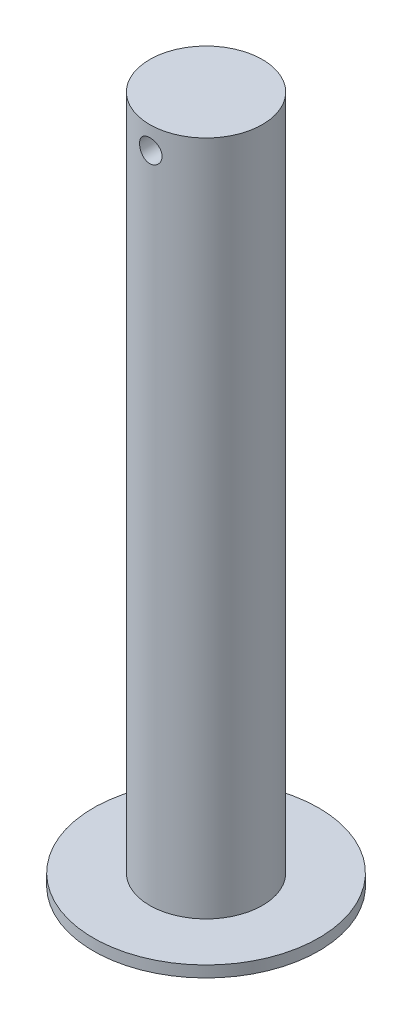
SolidWorks part; units mm, degrees
other "DetailItem2"
ref_plane "Front Plane" through (0, 0, 0) normal (0, 0, 1) x (1, 0, 0)
ref_plane "Top Plane" through (0, 0, 0) normal (0, 1, 0) x (1, 0, 0)
ref_plane "Right Plane" through (0, 0, 0) normal (1, 0, 0) x (0, 0, -1)
sketch "Sketch1" plane through (0, 0, 0) normal (0, 1, 0) x (1, 0, 0)
  circle A0 centre (0, 0) radius 12.7
  dimension "D1" = 25.4
extrude "Extrude1" add sketch "Sketch1" along normal blind 152.4
sketch "Sketch3" plane through (0, 0, 0) normal (0, 0, 1) x (1, 0, 0)
  circle A0 centre (0, 147.32) radius 2.54
  dimension "D1" = 5.08
  dimension "D2" = 147.32
extrude "Cut-Extrude1" cut sketch "Sketch3" against normal through all and the other way through all
sketch "Sketch4" plane through (0, 0, 0) normal (0, -1, 0) x (1, 0, 0)
  circle A0 centre (0, 0) radius 10.3187
  circle A1 centre (0, 0) radius 25.4
  dimension "D1" = 20.6375
  dimension "D2" = 50.8
extrude "Extrude2" add sketch "Sketch4" along normal blind 2.54 separate body
other "Fillet Bead2" parameters "D10"=6.35, "D11"=1.27, "D12"=0, "D13"=3.175, "D14"=0
